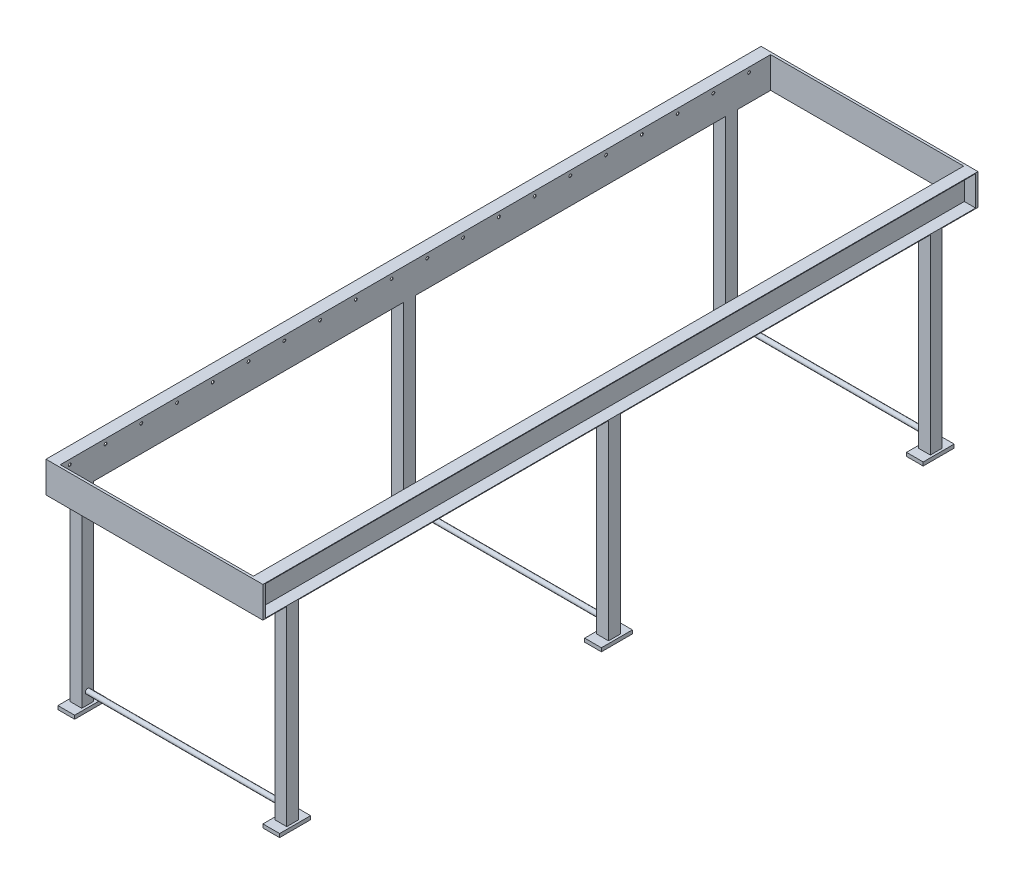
SolidWorks part; units mm, degrees
ref_plane "Ebene1" through (0, 0, 0) normal (0, 0, 1) x (1, 0, 0)
ref_plane "Ebene2" through (0, 0, 0) normal (0, 1, 0) x (1, 0, 0)
ref_plane "Ebene3" through (0, 0, 0) normal (1, 0, 0) x (0, 0, -1)
sketch "Skizze1" plane through (0, 0, 0) normal (0, 0, 1) x (1, 0, 0)
  line L0 (0, 130) -> (0, 0) construction
  line L1 (455, 130) -> (455, 0)
  line L2 (455, 130) -> (-455, 130)
  line L4 (455, 0) -> (-455, 0)
  line L5 (-455, 130) -> (-455, 0)
  dimension "D1" = 910
  dimension "D2" = 130
extrude "Basis-Linear austragen" add sketch "Skizze1" along normal blind 10
sketch "Skizze2" plane through (4.0866, 32.1216, 0) normal (0, 0, -1) x (-1, 0, 0)
  line L0 (4.0866, 12.8954) -> (4.0866, -32.1216) construction
  line L1 (-450.9134, 95.3784) -> (-403.4134, 95.3784)
  line L2 (-450.9134, -32.1216) -> (-400.9134, -32.1216)
  line L3 (-450.9134, -32.1216) -> (-450.9134, -29.6216)
  line L4 (-450.9134, 97.8784) -> (-400.9134, 97.8784)
  line L5 (-400.9134, -32.1216) -> (-400.9134, 97.8784)
  line L6 (-403.4134, 95.3784) -> (-403.4134, -29.6216)
  line L7 (-403.4134, -29.6216) -> (-450.9134, -29.6216)
  line L8 (-450.9134, 95.3784) -> (-450.9134, 97.8784)
  line L9 (459.0866, 95.3784) -> (459.0866, 97.8784)
  line L10 (411.5866, -29.6216) -> (459.0866, -29.6216)
  line L11 (411.5866, 95.3784) -> (411.5866, -29.6216)
  line L12 (409.0866, -32.1216) -> (409.0866, 97.8784)
  line L13 (459.0866, 97.8784) -> (409.0866, 97.8784)
  line L14 (459.0866, -32.1216) -> (459.0866, -29.6216)
  line L15 (459.0866, -32.1216) -> (409.0866, -32.1216)
  line L16 (459.0866, 95.3784) -> (411.5866, 95.3784)
  line L17 (459.0866, -32.1216) -> (-450.9134, -32.1216) construction
  line L18 (-450.9134, -32.1216) -> (-450.9134, 97.8784) construction
  dimension "D1" = 2.5
  dimension "D2" = 2.5
  dimension "D3" = 130
  dimension "D4" = 2.5
  dimension "D5" = 810
  dimension "D6" = 50
extrude "Aufsatz-Linear austragen1" add sketch "Skizze2" along normal blind 2980
sketch "Skizze3" plane through (0, 0, 0) normal (0, -1, 0) x (1, 0, 0)
  line L0 (-455, 10) -> (-455, -2980) construction
  line L1 (-455, -90) -> (-405, -90)
  line L2 (-455, -90) -> (-455, -140)
  line L3 (-455, -140) -> (-405, -140)
  line L4 (-405, -90) -> (-405, -140)
  line L5 (-405, -2980) -> (-405, 0) construction
  line L6 (-455, 10) -> (455, 10) construction
  line L7 (-453, -92) -> (-407, -92)
  line L8 (-407, -92) -> (-407, -138)
  line L9 (-453, -138) -> (-407, -138)
  line L10 (-453, -92) -> (-453, -138)
  dimension "D1" = 50
  dimension "D2" = 100
  dimension "D3" = 2
extrude "Aufsatz-Linear austragen2" add sketch "Skizze3" along normal blind 800
sketch "Skizze6" plane through (0, -800, 0) normal (0, -1, 0) x (1, 0, 0)
  line L0 (-405, -90) -> (-455, -90) construction
  line L1 (-395, -50) -> (-465, -50)
  line L2 (-395, -50) -> (-395, -180)
  line L3 (-395, -180) -> (-465, -180)
  line L5 (-455, -90) -> (-455, -140) construction
  line L6 (-405, -140) -> (-405, -90) construction
  line L8 (-455, -140) -> (-405, -140) construction
  line L12 (-465, -50) -> (-465, -180)
  dimension "D2" = 10
  dimension "D3" = 40
  dimension "D1" = 40
  dimension "D4" = 10
extrude "Aufsatz-Linear austragen6" add sketch "Skizze6" along normal blind 15
pattern_linear "Lineares Muster1" count 3 spacing 1350 along (0, 0, -1) count 2 spacing 860 along (1, 0, 0) of "Aufsatz-Linear austragen2", "Aufsatz-Linear austragen6"
sketch "Skizze5"
  line L0 (140, -800) -> (140, 0) construction
  line L2 (140, -800) -> (90, -800) construction
  circle A0 centre (115, -750) radius 10
  dimension "D1" = 20
  dimension "D2" = 25
  dimension "D3" = 50
extrude "Aufsatz-Linear austragen3" add sketch "Skizze4" along normal blind 10
sketch "Skizze4" plane through (0, 0, -2980) normal (0, 0, -1) x (-1, 0, 0)
  line L0 (-455, 2.5) -> (-455, 127.5) construction
  line L1 (455, 127.5) -> (455, 2.5) construction
  line L2 (-455, 0) -> (-455, 130)
  line L3 (455, 130) -> (455, 0)
  line L4 (405, 0) -> (-405, 0) construction
  line L5 (-405, 130) -> (405, 130) construction
  line L6 (455, 0) -> (-455, 0)
  line L7 (-455, 130) -> (455, 130)
extrude "Aufsatz-Linear austragen4" add sketch "Skizze5" along normal blind 810
pattern_linear "Lineares Muster2" count 3 spacing 1350 along (0, 0, -1) of "Aufsatz-Linear austragen4"
sketch "Skizze7" plane through (407.5, 0, 0) normal (1, 0, 0) x (0, 0, -1)
  line L0 (-10, 130) -> (2990, 130) construction
  line L1 (-10, 0) -> (-10, 130) construction
  circle A0 centre (40, 110) radius 6
  dimension "D1" = 12
  dimension "D2" = 20
  dimension "D3" = 50
extrude "Schnitt-Linear austragen1" cut sketch "Skizze7" against normal through all
pattern_linear "Lineares Muster3" count 20 spacing 150 along (0, 0, -1) of "Schnitt-Linear austragen1"
